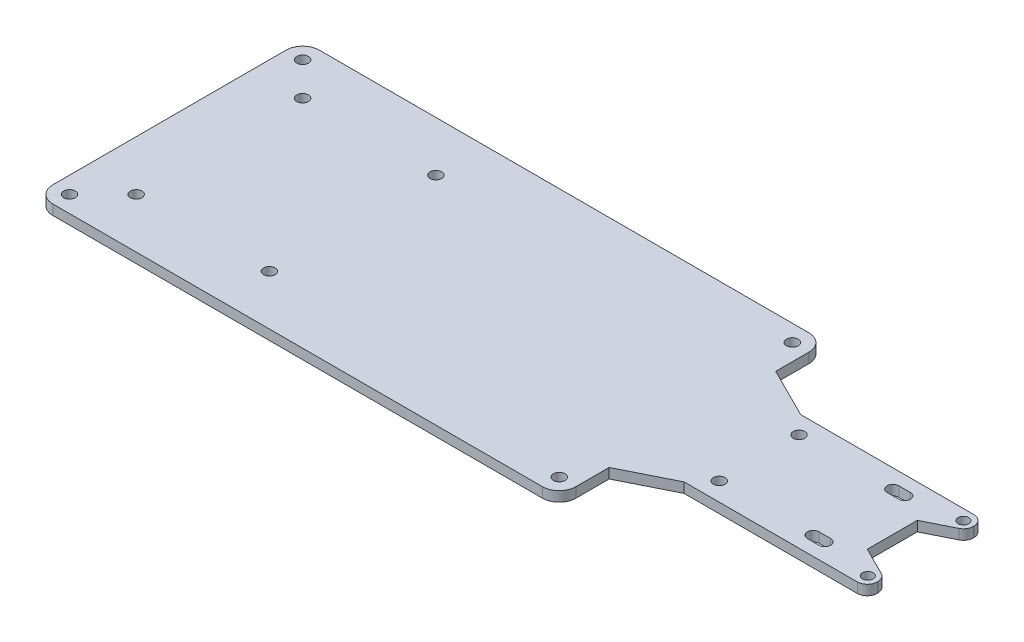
SolidWorks part; units mm, degrees
ref_plane "Front Plane" through (0, 0, 0) normal (0, 0, 1) x (1, 0, 0)
ref_plane "Top Plane" through (0, 0, 0) normal (0, 1, 0) x (1, 0, 0)
ref_plane "Right Plane" through (0, 0, 0) normal (1, 0, 0) x (0, 0, -1)
sketch "Sketch1" plane through (0, 0, 0) normal (0, 1, 0) x (1, 0, 0)
  line L0 (0, 0) -> (41449.7842, 0) construction
  line L1 (0, -30) -> (0, 30)
  line L2 (0, 30) -> (65, 30) construction
  line L3 (65, 30) -> (77, 40) construction
  line L4 (77, 40) -> (157, 40)
  line L5 (157, 40) -> (157, 25)
  line L6 (157, 25) -> (172, 17.5)
  line L7 (172, 17.5) -> (224, 17.5)
  line L8 (217, 7.5) -> (217, -7.5)
  line L9 (217, 7.5) -> (225.3416, 11.6708)
  line L10 (227, 14.3541) -> (227, 14.5)
  line L11 (217, -7.5) -> (225.3416, -11.6708)
  line L12 (227, -14.3541) -> (227, -14.5)
  line L13 (172, -17.5) -> (224, -17.5)
  line L14 (157, -25) -> (172, -17.5)
  line L15 (157, -40) -> (157, -25)
  line L16 (77, -40) -> (157, -40)
  line L17 (65, -30) -> (77, -40) construction
  line L18 (0, -30) -> (65, -30) construction
  line L19 (77, 40) -> (0, 40)
  line L20 (0, 40) -> (0, 30)
  line L21 (0, -30) -> (0, -40)
  line L22 (0, -40) -> (77, -40)
  arc A1 (224, 17.5) -> (227, 14.5) centre (224, 14.5) cw
  arc A2 (225.3416, 11.6708) -> (227, 14.3541) centre (224, 14.3541) ccw
  circle A3 centre (224, 14.3541) radius 1.6
  circle A4 centre (224, -14.3541) radius 1.6
  arc A5 (225.3416, -11.6708) -> (227, -14.3541) centre (224, -14.3541) cw
  arc A6 (224, -17.5) -> (227, -14.5) centre (224, -14.5) ccw
  point P6 (0, 0)
  point P17 (217, 0)
  point P18 (227, 17.5)
  point P21 (227, 12.5)
  dimension "D14" = 3
  dimension "D16" = 3.2
  dimension "D2" = 65
  dimension "D3" = 12
  dimension "D4" = 80
  dimension "D5" = 35
  dimension "D6" = 10
  dimension "D7" = 80
  dimension "D8" = 30
  dimension "D9" = 15
  dimension "D10" = 15
  dimension "D11" = 55
  dimension "D12" = 10
  dimension "D13" = 5
  dimension "D15" = 15
extrude "Boss-Extrude1" add sketch "Sketch1" along normal blind 3
fillet "Fillet1" radius 5 4 edges at (157, 1.5, 40) (157, 1.5, -40) (0, 1.5, 40) (0, 1.5, -40)
sketch "Sketch2" plane through (0, 3, 0) normal (0, 1, 0) x (1, 0, 0)
  line L1 (15, -25) -> (55, -25) construction
  line L2 (15, -25) -> (15, 25) construction
  line L3 (15, 25) -> (55, 25) construction
  line L4 (55, -25) -> (55, 25) construction
  line L5 (15, -25) -> (55, 25) construction
  line L6 (15, 25) -> (55, -25) construction
  circle A0 centre (15, 25) radius 1.75
  circle A1 centre (55, 25) radius 1.75
  circle A2 centre (55, -25) radius 1.75
  circle A3 centre (15, -25) radius 1.75
  point P0 (35, 0)
  dimension "D1" = 3.5
  dimension "D2" = 3.5
  dimension "D3" = 3.5
  dimension "D4" = 3.5
  dimension "D5" = 50
  dimension "D6" = 40
  dimension "D7" = 35
extrude "Cut-Extrude1" cut sketch "Sketch2" against normal through all both and the other way through all
sketch "Sketch3" plane through (0, 3, 0) normal (0, 1, 0) x (1, 0, 0)
  circle A0 centre (5, 35) radius 1.75
  circle A1 centre (5, -35) radius 1.75
  circle A2 centre (152, 35) radius 1.75
  circle A3 centre (152, -35) radius 1.75
  dimension "D1" = 3.5
  dimension "D2" = 3.5
  dimension "D3" = 3.5
  dimension "D4" = 3.5
extrude "Cut-Extrude2" cut sketch "Sketch3" against normal blind 10
sketch "Sketch4" plane through (0, 3, 0) normal (0, 1, 0) x (1, 0, 0)
  line L0 (217, -7.5) -> (217, 7.5) construction
  line L1 (177.024, -11.975) -> (206.976, -11.975) construction
  line L2 (177.024, -11.975) -> (177.024, 11.975) construction
  line L3 (177.024, 11.975) -> (206.976, 11.975) construction
  line L4 (206.976, -11.975) -> (206.976, 11.975) construction
  line L5 (177.024, -11.975) -> (206.976, 11.975) construction
  line L6 (177.024, 11.975) -> (206.976, -11.975) construction
  line L7 (205.226, 11.975) -> (208.726, 11.975) construction
  line L8 (205.226, 13.725) -> (208.726, 13.725)
  line L9 (205.226, 10.225) -> (208.726, 10.225)
  line L10 (205.226, -11.975) -> (208.726, -11.975) construction
  line L11 (205.226, -10.225) -> (208.726, -10.225)
  line L12 (205.226, -13.725) -> (208.726, -13.725)
  circle A0 centre (177.024, 11.975) radius 1.75
  circle A1 centre (206.976, 11.975) radius 1.75 construction
  circle A2 centre (206.976, -11.975) radius 1.75 construction
  circle A3 centre (177.024, -11.975) radius 1.75
  arc A4 (205.226, 13.725) -> (205.226, 10.225) centre (205.226, 11.975) ccw
  arc A5 (208.726, 10.225) -> (208.726, 13.725) centre (208.726, 11.975) ccw
  arc A6 (205.226, -10.225) -> (205.226, -13.725) centre (205.226, -11.975) ccw
  arc A7 (208.726, -13.725) -> (208.726, -10.225) centre (208.726, -11.975) ccw
  point P0 (192, 0)
  point P11 (217, 0)
  point P13 (206.976, 11.975)
  point P21 (206.976, -11.975)
  dimension "D1" = 3.5
  dimension "D2" = 3.5
  dimension "D3" = 3.5
  dimension "D4" = 3.5
  dimension "D8" = 1.75
  dimension "D9" = 1.75
  dimension "D5" = 38.35
  dimension "D6" = 25
  dimension "D7" = 23.95
extrude "Cut-Extrude3" cut sketch "Sketch4" against normal blind 10
